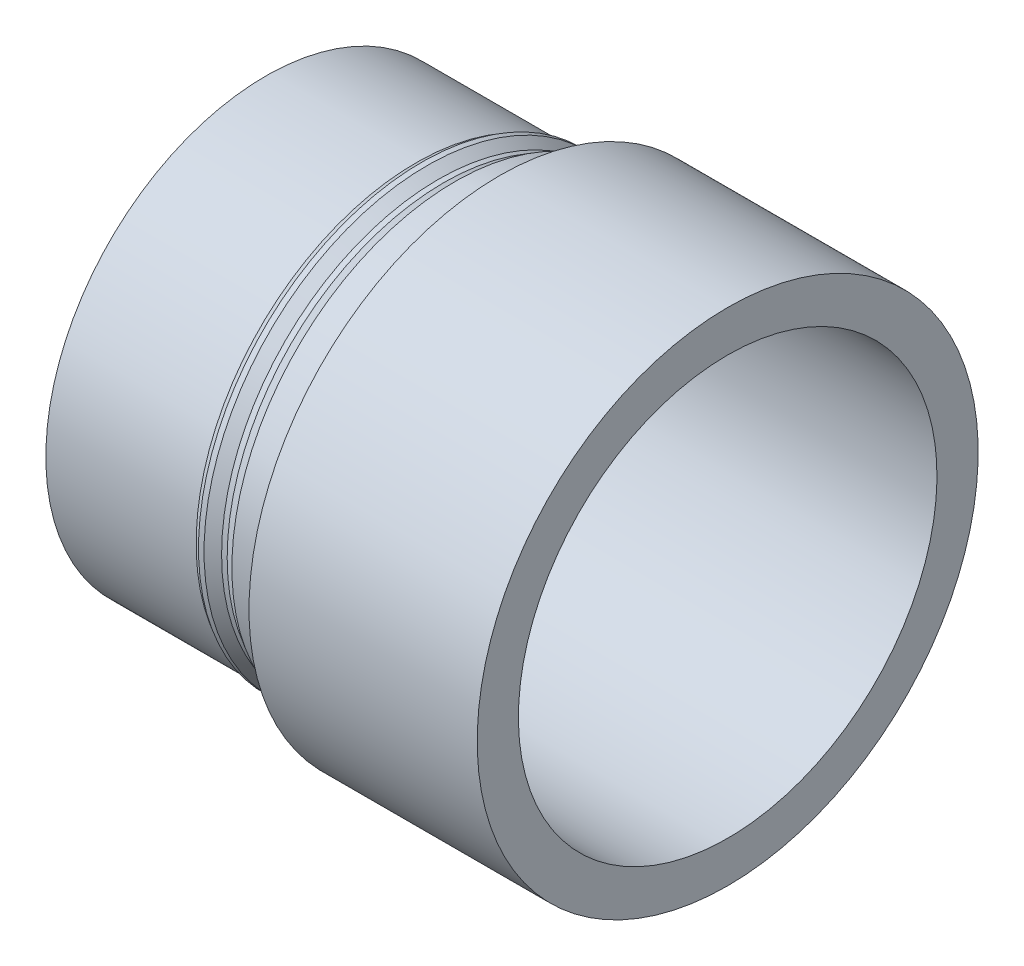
SolidWorks part; units mm, degrees
ref_plane "Alzado" through (0, 0, 0) normal (0, 0, 1) x (1, 0, 0)
ref_plane "Planta" through (0, 0, 0) normal (0, 1, 0) x (1, 0, 0)
ref_plane "Vista lateral" through (0, 0, 0) normal (1, 0, 0) x (0, 0, -1)
sketch "Croquis1" plane through (0, 0, 0) normal (0, 0, 1) x (1, 0, 0)
  line L0 (0, 0) -> (42, 0) construction
  line L1 (0, 0) -> (0, 39.5)
  line L2 (0, 39.5) -> (27, 39.5)
  line L3 (27, 39.5) -> (28, 40.0774)
  line L4 (28, 40.0774) -> (29, 40.0774)
  line L5 (28.5, 40.0774) -> (28.5, 0) construction
  line L6 (30, 39.5) -> (29, 40.0774)
  line L7 (30, 39.5) -> (31, 38.9226)
  line L8 (31, 38.9226) -> (32, 38.9226)
  line L9 (31.5, 38.9226) -> (31.5, 0) construction
  line L10 (33, 39.5) -> (32, 38.9226)
  line L11 (33, 39.5) -> (34, 40.0774)
  line L12 (34, 40.0774) -> (39, 40.0774)
  line L14 (42, 0) -> (0, 0)
  line L17 (42, 41.0774) -> (42, 0)
  line L18 (39, 40.0774) -> (42, 41.0774)
  dimension "D1" = 79
  dimension "D2" = 27
  dimension "D3" = 1
  dimension "D4" = 1
  dimension "D5" = 150
  dimension "D6" = 1
  dimension "D7" = 1
  dimension "D8" = 5
  dimension "D9" = 3
  dimension "D10" = 1
revolve "Revolución1" add sketch "Croquis1" angle 360 about L14
sketch "Croquis2" plane through (42, 0, 0) normal (1, 0, 0) x (0, 0, -1)
  circle A0 centre (0, 0) radius 45
  dimension "D1" = 90
extrude "Saliente-Extruir1" add sketch "Croquis2" along normal blind 41
sketch "Croquis3" plane through (83, 0, 0) normal (1, 0, 0) x (0, 0, -1)
  circle A0 centre (0, 0) radius 37.6
  dimension "D1" = 75.2
extrude "Cortar-Extruir1" cut sketch "Croquis3" against normal through all
